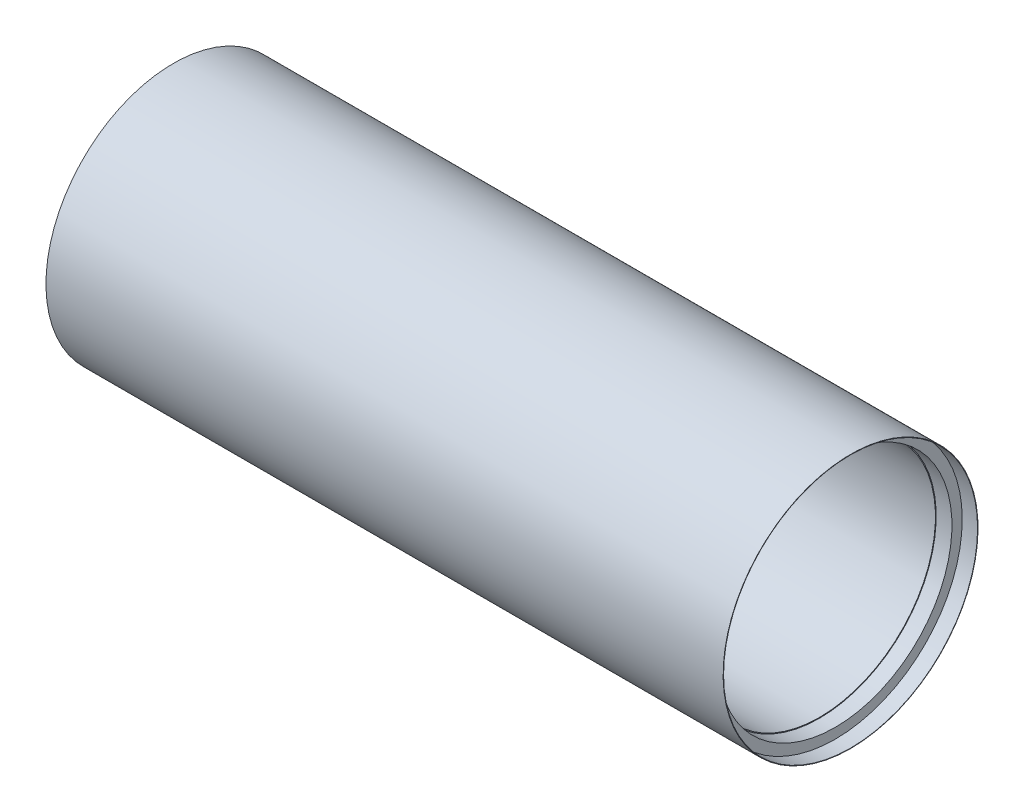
SolidWorks part; units mm, degrees
ref_plane "Front" through (0, 0, 0) normal (0, 0, 1) x (1, 0, 0)
ref_plane "Top" through (0, 0, 0) normal (0, 1, 0) x (1, 0, 0)
ref_plane "Right" through (0, 0, 0) normal (1, 0, 0) x (0, 0, -1)
sketch "Sketch1" plane through (0, 0, 0) normal (0, 0, 1) x (1, 0, 0)
  line L0 (0, 83.9724) -> (10.16, 83.9724)
  line L1 (10.16, 83.9724) -> (10.16, 77.2414)
  line L2 (20.574, 76.7334) -> (427.5582, 76.7334)
  line L3 (437.9722, 77.2414) -> (437.9722, 84.0486)
  line L4 (437.9722, 84.0486) -> (448.1322, 84.0486)
  line L5 (448.1322, 84.0486) -> (448.1322, 84.3534)
  line L6 (448.1322, 84.3534) -> (0, 84.3534)
  line L7 (0, 84.3534) -> (0, 83.9724)
  line L8 (0, 0) -> (134.0356, 0) construction
  line L9 (10.16, 77.2414) -> (20.574, 77.2414)
  line L10 (20.574, 77.2414) -> (20.574, 76.7334)
  line L11 (437.9722, 77.2414) -> (427.5582, 77.2414)
  line L12 (427.5582, 77.2414) -> (427.5582, 76.7334)
  line L13 (0, 0) -> (0, 83.9724) construction
  dimension "D1" = 76.7334
  dimension "D2" = 0.381
  dimension "D3" = 10.16
  dimension "D4" = 10.16
  dimension "D5" = 427.8122
  dimension "D6" = 84.3534
  dimension "D7" = 0.3048
  dimension "D8" = 10.414
  dimension "D9" = 10.414
  dimension "D10" = 0.508
  dimension "D11" = 0.508
revolve "Revolve1" add sketch "Sketch1" angle 360 about L8
